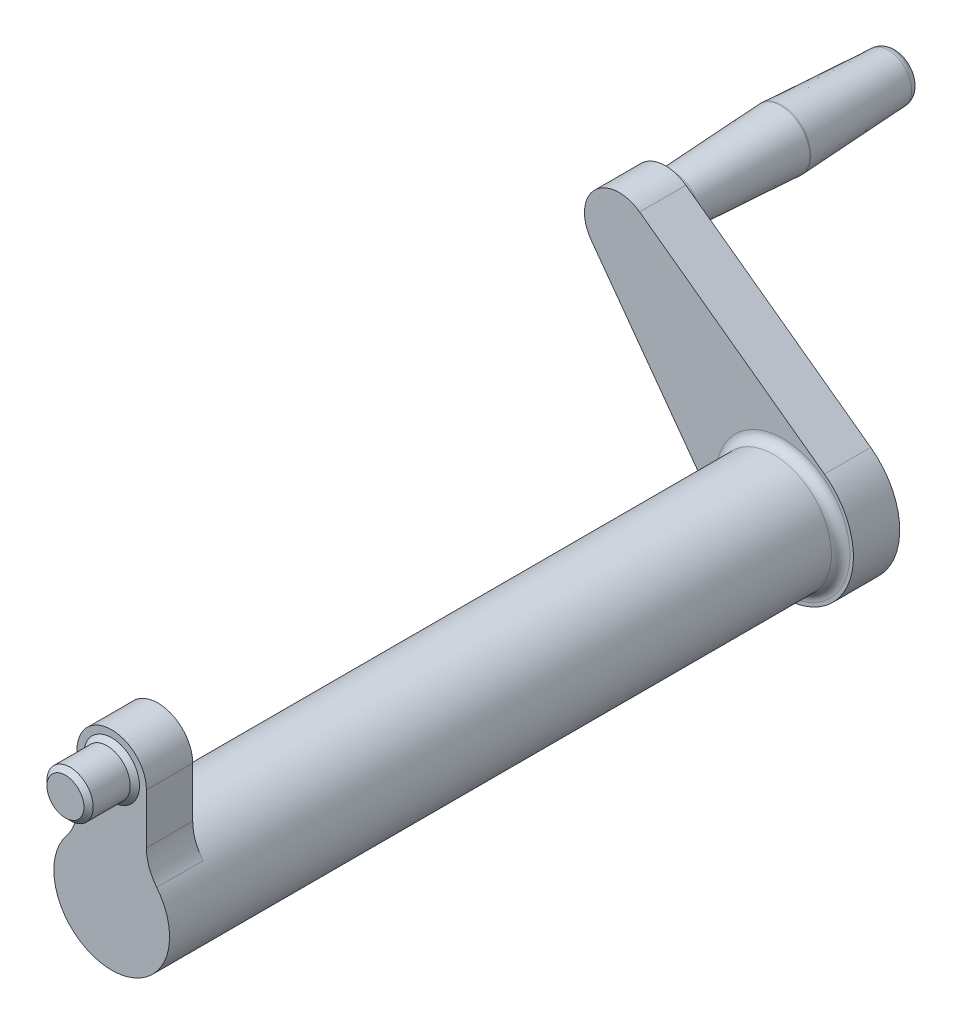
SolidWorks part; units mm, degrees
ref_plane "Front Plane" through (0, 0, 0) normal (0, 0, 1) x (1, 0, 0)
ref_plane "Top Plane" through (0, 0, 0) normal (0, 1, 0) x (1, 0, 0)
ref_plane "Right Plane" through (0, 0, 0) normal (1, 0, 0) x (0, 0, -1)
sketch "Sketch1" plane through (0, 0, 0) normal (0, 0, 1) x (1, 0, 0)
  circle A0 centre (0, 0) radius 12.5
  dimension "D1" = 25
extrude "Boss-Extrude1" add sketch "Sketch1" along normal blind 145
sketch "Sketch2" plane through (0, 0, 145) normal (0, 0, 1) x (1, 0, 0)
  line L0 (0, 25) -> (0, 0) construction
  line L1 (-7.5, 25) -> (-7.5, 10)
  line L2 (7.5, 25) -> (7.5, 10)
  arc A1 (7.5, 25) -> (-7.5, 25) centre (0, 25) ccw
  arc A2 (-7.5, 10) -> (7.5, 10) centre (0, 0) ccw
  dimension "D2" = 15
  dimension "D1" = 25
extrude "Boss-Extrude3" add sketch "Sketch2" along normal blind 10
sketch "Sketch4" plane through (0, 0, 155) normal (0, 0, 1) x (1, 0, 0)
  circle A0 centre (0, 25) radius 5
  dimension "D1" = 25
  dimension "D2" = 10
extrude "Boss-Extrude4" add sketch "Sketch4" along normal blind 10
chamfer "Chamfer1" distance 1 angle 45 2 edges at (5, 25, 165) (5, 25, 155)
fillet "Fillet1" radius 10 2 edges at (-7.5, 10, 150) (7.5, 10, 150)
sketch "Sketch5" plane through (0, 0, 0) normal (0, 0, -1) x (-1, 0, 0)
  line L0 (35.3553, 35.3553) -> (0, 0) construction
  line L2 (-8.9844, 12.3324) -> (30.9391, 41.4173)
  line L3 (12.3324, -8.9844) -> (41.4173, 30.9391)
  arc A0 (-8.9844, 12.3324) -> (12.3324, -8.9844) centre (0, 0) ccw
  arc A1 (41.4173, 30.9391) -> (30.9391, 41.4173) centre (35.3553, 35.3553) ccw
  dimension "D3" = 15
  dimension "D2" = 50
extrude "Boss-Extrude5" add sketch "Sketch5" against normal blind 10
fillet "Fillet2" radius 2 1 edges at (-12.5, 0, 10)
sketch "Sketch6" plane through (0, 0, 0) normal (0, 0, -1) x (-1, 0, 0)
  circle A0 centre (35.3553, 35.3553) radius 5
  dimension "D1" = 10
extrude "Boss-Extrude6" add sketch "Sketch6" along normal blind 25 draft 3
mirror "Mirror1" of "Boss-Extrude6"
fillet "Fillet3" radius 2 3 edges at (-40.3553, 35.3553, -50) (-41.6655, 35.3553, -25) (-30.3553, 35.3553, 0)
